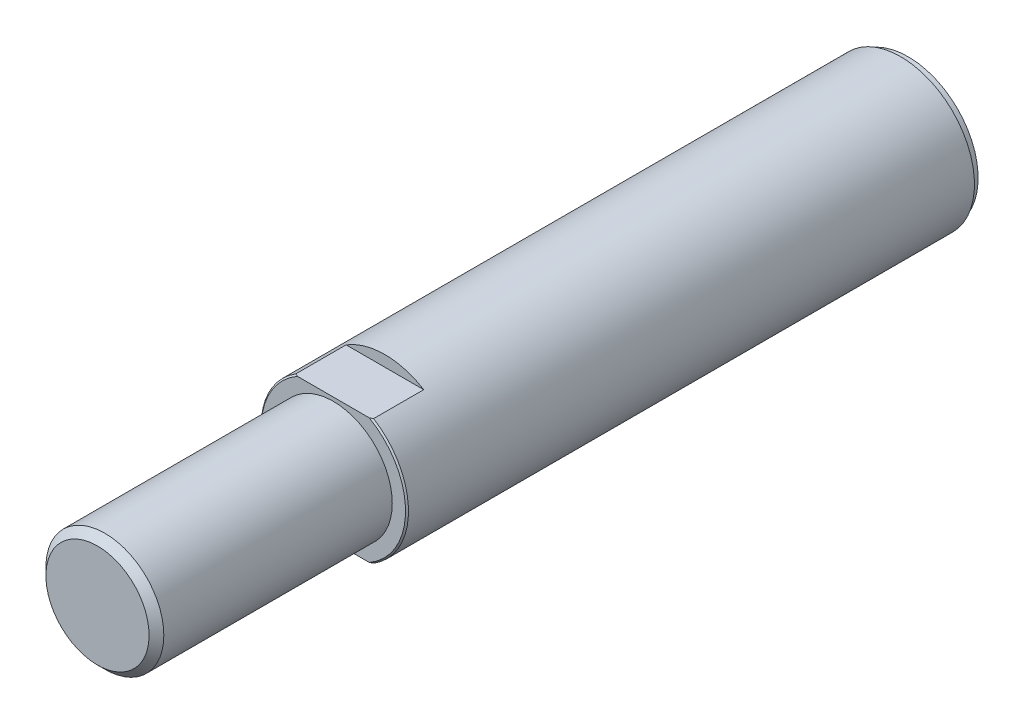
SolidWorks part; units mm, degrees
ref_plane "Plano frontal" through (0, 0, 0) normal (0, 0, 1) x (1, 0, 0)
ref_plane "Plano superior" through (0, 0, 0) normal (0, 1, 0) x (1, 0, 0)
ref_plane "Plano direito" through (0, 0, 0) normal (1, 0, 0) x (0, 0, -1)
sketch "Esboço1" plane through (0, 0, 0) normal (0, 0, 1) x (1, 0, 0)
  circle A0 centre (0, 0) radius 10
  dimension "D1" = 20
extrude "Ressalto-extrusão1" add sketch "Esboço1" along normal blind 110
sketch "Esboço2" plane through (0, 0, 110) normal (0, 0, 1) x (1, 0, 0)
  circle A0 centre (0, 0) radius 8
  dimension "D1" = 16
extrude "Corte-extrusão1" cut sketch "Esboço2" against normal blind 32 flip side to cut
hole_wizard "Furo roscado de M10x1.51" positions "Esboço5" profile "Esboço4" tap size "M10x1.5" standard "Ansi Metric"
sketch "Esboço5" plane through (0, 0, 0) normal (0, 0, -1) x (-1, 0, 0)
  point P0 (0, 0)
sketch "Esboço4" plane through (0, 0, 0) normal (1, 0, 0) x (0, 1, 0)
  line L0 (0, 0) -> (0, 30.0537)
  line L1 (0, 30.0537) -> (4.25, 27.5)
  line L2 (4.25, 27.5) -> (4.25, 0)
  line L5 (4.25, 0) -> (0, 0)
  line L10 (0, 30.0537) -> (-4.25, 27.5) construction
  line L11 (0, -6.35) -> (0, 107.95) construction
  dimension "Tap Drill Dia." = 8.5
  dimension "Tap Drill Depth" = 27.5
  dimension "Drill Angle" = 118
sketch "Esboço6" plane through (0, 0, 0) normal (0, 0, -1) x (-1, 0, 0)
  circle A0 centre (0, 0) radius 9.5
  dimension "D1" = 19
extrude "Corte-extrusão2" cut sketch "Esboço6" against normal blind 1 flip side to cut
chamfer "Chanfro1" distance 1 angle 45 1 edges at (8, 0, 110)
chamfer "Chanfro2" distance 0.2 angle 45 1 edges at (10, 0, 78)
sketch "Esboço7" plane through (0, 0, 78) normal (0, 0, 1) x (1, 0, 0)
  line L1 (-15.7371, -8.5) -> (15.7371, -8.5)
  line L2 (-15.7371, -8.5) -> (-15.7371, 8.5)
  line L3 (-15.7371, 8.5) -> (15.7371, 8.5)
  line L4 (15.7371, -8.5) -> (15.7371, 8.5)
  line L5 (-15.7371, -8.5) -> (15.7371, 8.5) construction
  line L6 (-15.7371, 8.5) -> (15.7371, -8.5) construction
  point P0 (0, 0)
  dimension "D1" = 17
extrude "Corte-extrusão3" cut sketch "Esboço7" against normal blind 7 flip side to cut
